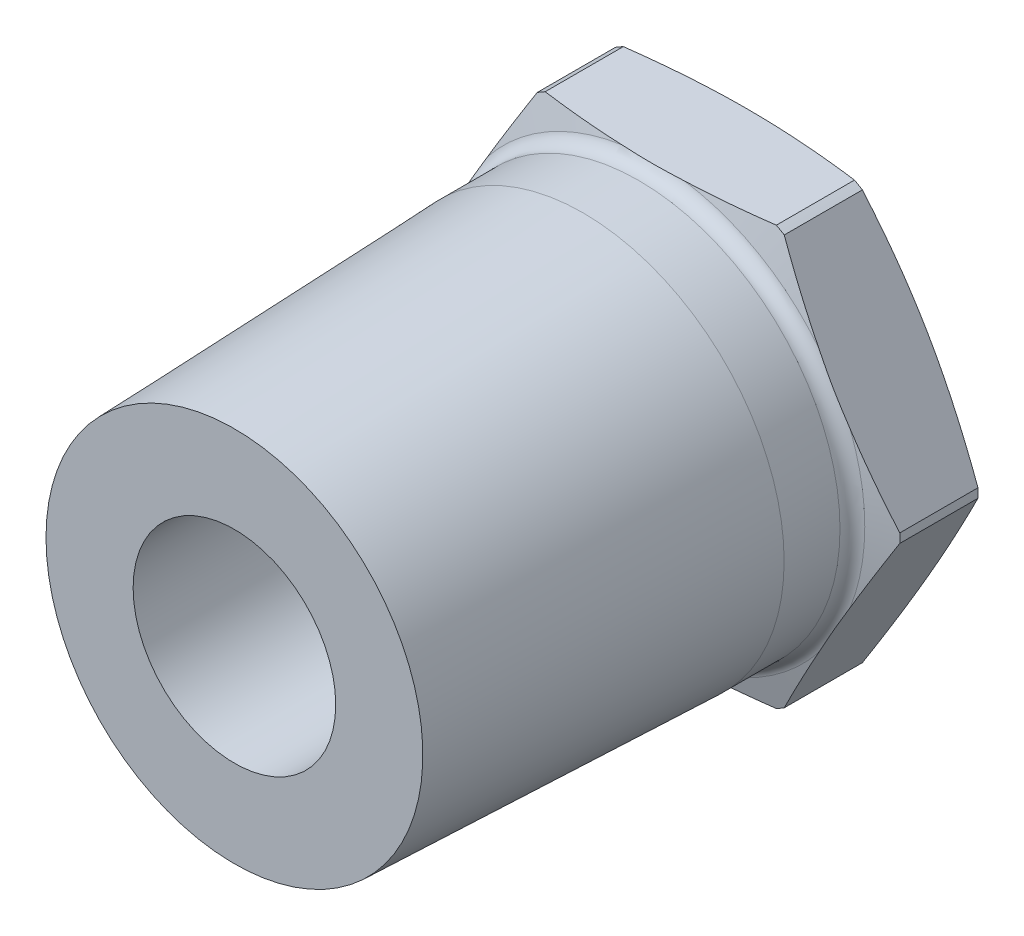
SolidWorks part; units mm, degrees
ref_plane "Front Plane" through (0, 0, 0) normal (0, 0, 1) x (1, 0, 0)
ref_plane "Top Plane" through (0, 0, 0) normal (0, 1, 0) x (1, 0, 0)
ref_plane "Right Plane" through (0, 0, 0) normal (1, 0, 0) x (0, 0, -1)
sketch "Sketch4" plane through (0, 0, 0) normal (1, 0, 0) x (0, 0, -1)
  line L0 (-0.762, 8.1534) -> (-3.937, 8.1534)
  line L1 (-3.937, 8.1534) -> (-3.937, 7.366)
  line L2 (-4.445, 6.858) -> (-6.35, 6.858)
  line L3 (-6.35, 6.858) -> (-18.2372, 6.4252)
  line L4 (-18.2372, 6.4252) -> (-18.2372, 0)
  line L5 (-18.2372, 0) -> (-0.762, 0)
  line L6 (-0.762, 0) -> (-0.762, 8.1534)
  line L10 (1.6991, 0) -> (-20.1593, 0) construction
  arc A0 (-3.937, 7.366) -> (-4.445, 6.858) centre (-4.445, 7.366) cw
  dimension "D8" = 0.508
  dimension "D1" = 0.762
  dimension "D2" = 3.175
  dimension "D3" = 5.588
  dimension "D4" = 2.085
  dimension "D5" = 17.4752
  dimension "D6" = 13.716
  dimension "D7" = 16.3068
revolve "Revolve2" add sketch "Sketch4" angle 360 about L10
chamfer "Chamfer1" distance 1.016 angle 15 2 edges at (-8.1534, 0, 0.762) (-8.1534, 0, 3.937)
sketch "Sketch5" plane through (0, 0, 0.762) normal (0, 0, -1) x (-1, 0, 0)
  line L1 (-4.1208, 7.1374) -> (-8.2416, 0)
  line L2 (-8.2416, 0) -> (-4.1208, -7.1374)
  line L3 (-4.1208, -7.1374) -> (4.1208, -7.1374)
  line L4 (4.1208, -7.1374) -> (8.2416, 0)
  line L5 (8.2416, 0) -> (4.1208, 7.1374)
  line L6 (4.1208, 7.1374) -> (-4.1208, 7.1374)
  circle A0 centre (0, 0) radius 7.1374 construction
  dimension "D1" = 14.2748
extrude "Cut-Extrude1" cut sketch "Sketch5" against normal through all flip side to cut
hole_wizard "1/8 NPT Tapped Hole2" positions "Sketch9" profile "Sketch11" size "1/8" standard "ANSI Inch"
sketch "Sketch9" plane through (0, 0, 0.762) normal (0, 0, -1) x (-1, 0, 0)
  point P0 (0, 0)
sketch "Sketch11" plane through (0, 0, 0.762) normal (1, 0, 0) x (0, 1, 0)
  line L0 (0, 0) -> (0, 17.4752)
  line L1 (0, 17.4752) -> (3.4417, 17.4752)
  line L2 (-4.9362, 8.89) -> (-5.2024, 0) construction
  line L3 (3.4417, 17.4752) -> (3.4417, 8.89)
  line L4 (3.4417, 8.89) -> (4.9362, 8.89)
  line L5 (4.9362, 8.89) -> (5.2024, 0)
  line L7 (5.2024, 0) -> (0, 0)
  line L8 (0, -6.35) -> (0, 107.95) construction
  line L11 (-3.4417, 8.89) -> (-4.9362, 8.89) construction
  dimension "Thru Tap Drill Dia." = 6.8834
  dimension "Thru Tap Drill Depth" = 17.4752
  dimension "Thread Dia." = 10.4047
  dimension "Thread Angle" = 3.43
  dimension "Thread Depth" = 8.89
hole_wizard "5/16-24 Tapped Hole1" positions "Sketch12" profile "Sketch13" tap size "5/16-24" standard "ANSI Inch"
sketch "Sketch12" plane through (0, 0, 18.2372) normal (0, 0, 1) x (1, 0, 0)
  point P0 (0, 0)
sketch "Sketch13" plane through (0, 0, 18.2372) normal (1, 0, 0) x (0, -1, 0)
  line L0 (0, 0) -> (0, 17.4752)
  line L1 (0, 17.4752) -> (3.4544, 17.4752)
  line L2 (3.4544, 17.4752) -> (3.4544, 0)
  line L5 (3.4544, 0) -> (0, 0)
  line L11 (0, -6.35) -> (0, 107.95) construction
  dimension "Thru Tap Drill Dia." = 6.9088
  dimension "Thru Tap Drill Depth" = 17.4752
